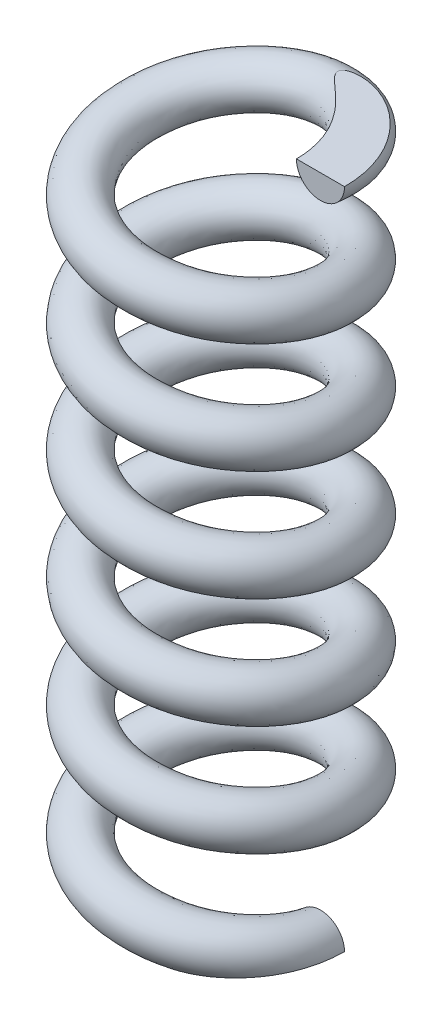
SolidWorks part; units mm, degrees
ref_plane "Front Plane" through (0, 0, 0) normal (0, 0, 1) x (1, 0, 0)
ref_plane "Top Plane" through (0, 0, 0) normal (0, 1, 0) x (1, 0, 0)
ref_plane "Right Plane" through (0, 0, 0) normal (1, 0, 0) x (0, 0, -1)
sketch "Sketch2" plane through (0, 0, 0) normal (0, 0, 1) x (1, 0, 0)
  line L0 (0, 0) -> (0, -99.9)
  dimension "D1" = 99.9
sketch "Sketch3" plane through (0, 0, 0) normal (0, 0, 1) x (1, 0, 0)
  circle A0 centre (15, -99.9) radius 3.625
  dimension "D1springdia" = 7.25
  dimension "D2" = 15
sweep "Sweep1" add profiles "Sketch3" path "Sketch2" parameters "D4"=2160
sketch "Sketch4" plane through (0, 0, 0) normal (0, 1, 0) x (1, 0, 0)
  circle A0 centre (0, 0) radius 27.358
extrude "Cut-Extrude1" cut sketch "Sketch4" along normal blind 10
ref_plane "Plane1" through (0, -99.9, 0) normal (0, 1, 0) x (1, 0, 0)
sketch "Sketch5" plane through (0, -99.9, 0) normal (0, 1, 0) x (1, 0, 0)
  circle A0 centre (0, 0) radius 28.1568
extrude "Cut-Extrude2" cut sketch "Sketch5" against normal blind 10
